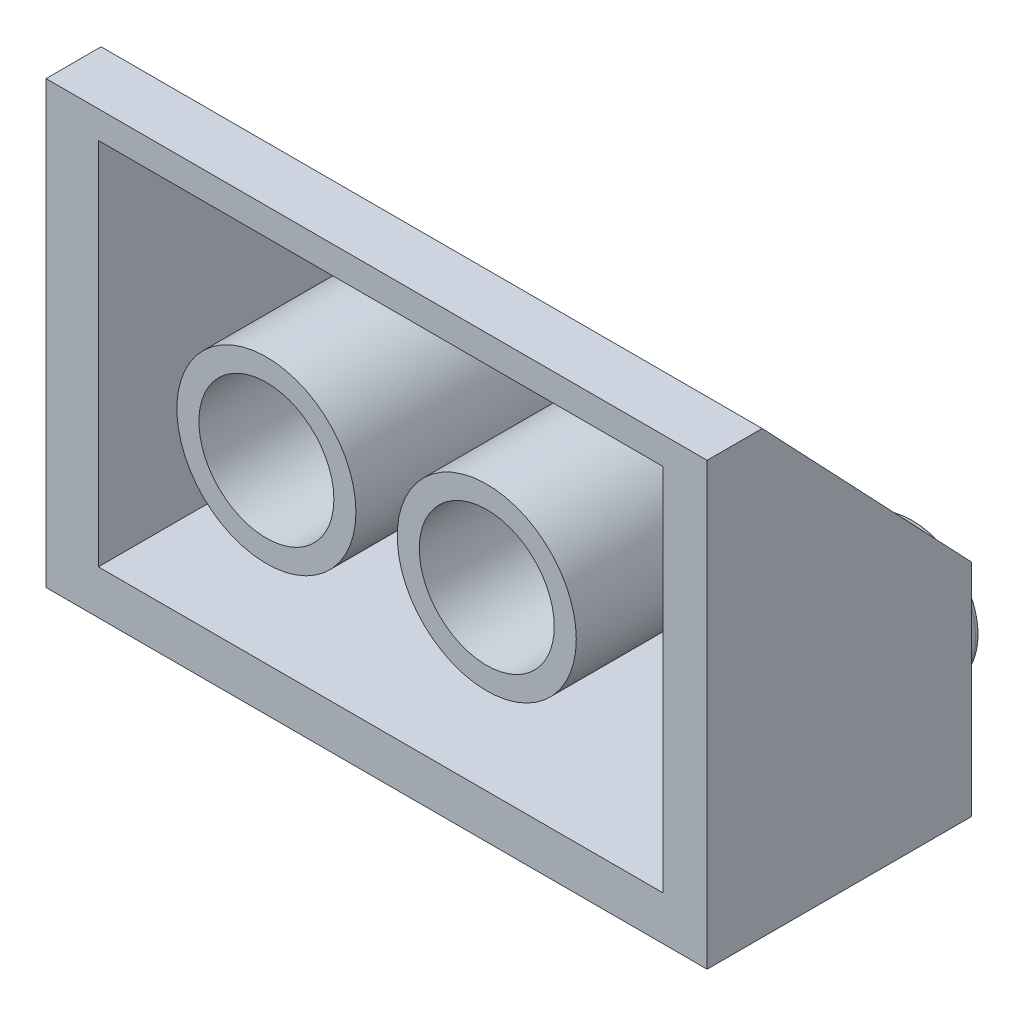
SolidWorks part; units mm, degrees
ref_plane "Vorne" through (0, 0, 0) normal (0, 0, 1) x (1, 0, 0)
ref_plane "Oben" through (0, 0, 0) normal (0, 1, 0) x (1, 0, 0)
ref_plane "Rechts" through (0, 0, 0) normal (1, 0, 0) x (0, 0, -1)
sketch "Skizze1" plane through (0, 0, 0) normal (0, 0, 1) x (1, 0, 0)
  line L1 (0, 0) -> (-24, 0)
  line L2 (0, 0) -> (0, -8)
  line L3 (0, -8) -> (-24, -8)
  line L4 (-24, 0) -> (-24, -8)
  dimension "D1" = 24
  dimension "D2" = 8
extrude "Linear austragen1" add sketch "Skizze1" along normal blind 9.6
sketch "Skizze2" plane through (0, 0, 9.6) normal (0, 0, 1) x (1, 0, 0)
  line L0 (-24, -8) -> (0, -8) construction
  line L1 (-1.6, -6.4) -> (-22.1, -6.4)
  line L2 (-1.6, -6.4) -> (-1.6, 6.2)
  line L3 (-1.6, 6.2) -> (-22.1, 6.2)
  line L4 (-22.1, -6.4) -> (-22.1, 6.2)
  line L5 (0, -8) -> (0, 0) construction
  dimension "D1" = 12.6
  dimension "D2" = 20.5
  dimension "D3" = 1.6
  dimension "D4" = 1.6
extrude "Schnitt-Linear austragen1" cut sketch "Skizze2" against normal blind 8.5
sketch "Skizze4" plane through (0, 0, 0) normal (0, 0, -1) x (-1, 0, 0)
  line L0 (0, 0) -> (24, 0) construction
  line L1 (0, -8) -> (0, 0) construction
  circle A0 centre (4, -4) radius 2.45
  dimension "D1" = 4.9
  dimension "D2" = 4
  dimension "D3" = 4
extrude "Linear austragen3" add sketch "Skizze4" along normal blind 1.9
fillet "Verrundung1" radius 0.2 1 edges at (-6.45, -4, -1.9)
sketch "Skizze6" plane through (0, 0, 0) normal (1, 0, 0) x (0, 0, -1)
  line L0 (0, 0) -> (-7.6, 8)
  line L1 (-7.6, 8) -> (-9.6, 8)
  line L2 (-9.6, 8) -> (-9.6, 0)
  line L3 (-9.6, 0) -> (0, 0)
  dimension "D1" = 8
  dimension "D2" = 2
  dimension "D3" = 9.6
extrude "Linear austragen4" add sketch "Skizze6" against normal blind 24
sketch "Skizze7" plane through (-22.1, 0, 0) normal (1, 0, 0) x (0, 0, -1)
  line L0 (-1.1, 0) -> (-7.8, 7.0052)
  line L1 (-7.8, 7.0052) -> (-9.6, 7.0052)
  line L3 (-9.6, 0) -> (-1.1, 0)
  line L5 (-9.6, -8) -> (-9.6, 8) construction
  line L6 (-9.6, 7.0052) -> (-9.6, 0)
  dimension "D1" = 1.8
extrude "Schnitt-Linear austragen2" cut sketch "Skizze7" along normal blind 20.5
sketch "Skizze3" plane through (0, 0, 9.6) normal (0, 0, 1) x (1, 0, 0)
  line L0 (0, -8) -> (0, 8) construction
  line L1 (-24, -8) -> (0, -8) construction
  circle A0 centre (-8, 0) radius 3.25
  circle A1 centre (-8, 0) radius 2.45
  dimension "D1" = 6.5
  dimension "D2" = 4.9
  dimension "D3" = 8
  dimension "D4" = 8
extrude "Linear austragen2" add sketch "Skizze3" against normal blind 8.5
sketch "Skizze8" plane through (0, 0, 1.1) normal (0, 0, 1) x (1, 0, 0)
  line L0 (-24, -8) -> (0, -8) construction
  line L2 (0, -8) -> (0, 8) construction
  circle A0 centre (-4, -4) radius 1.25
  dimension "D1" = 4
  dimension "D2" = 4
  dimension "D3" = 2.5
extrude "Schnitt-Linear austragen3" cut sketch "Skizze8" against normal blind 1.8
pattern_linear "Lineares Muster3" count 3 spacing 8 along (-1, 0, 0) of "Schnitt-Linear austragen3", "Verrundung1", "Linear austragen3"
pattern_linear "Lineares Muster4" count 2 spacing 8 along (-1, 0, 0) of "Linear austragen2"
sketch "Skizze10" plane through (-24, 0, 0) normal (-1, 0, 0) x (0, 0, 1)
  line L0 (1.1, 1.1579) -> (3.0875, 3.25)
  line L1 (0, 0) -> (7.6, 8) construction
  line L2 (3.0875, 3.25) -> (1.1, 3.25)
  line L3 (1.1, 3.25) -> (1.1, 1.1579)
extrude "Schnitt-Linear austragen4" cut sketch "Skizze10" against normal blind 24
